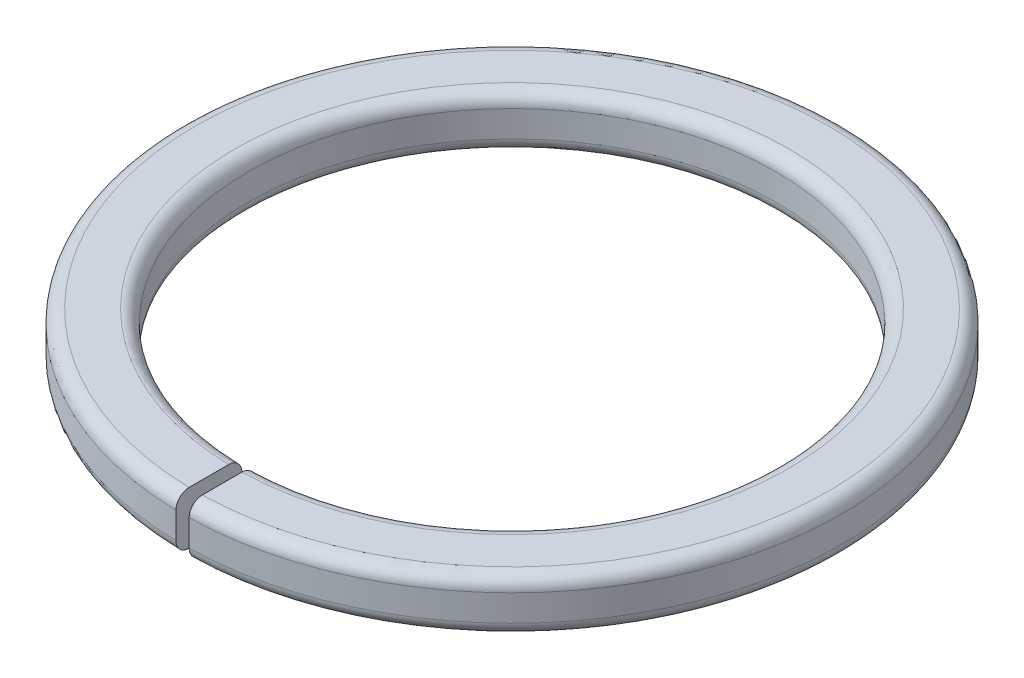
SolidWorks part; units mm, degrees
ref_plane "Front" through (0, 0, 0) normal (0, 0, 1) x (1, 0, 0)
ref_plane "Top" through (0, 0, 0) normal (0, 1, 0) x (1, 0, 0)
ref_plane "Right" through (0, 0, 0) normal (1, 0, 0) x (0, 0, -1)
sketch "Sketch1" plane through (0, 0, 0) normal (0, 1, 0) x (1, 0, 0)
  circle A0 centre (0, 0) radius 5
  circle A1 centre (0, 0) radius 4
extrude "Extrude1" add sketch "Sketch1" along normal blind 0.8
fillet "Fillet2" radius 0.2 4 edges at (0, 0, 5) (0, 0, 4) (0, 0.8, 4) (0, 0.8, 5)
sketch "Sketch2" plane through (0, 0.8, 0) normal (0, 1, 0) x (-1, 0, 0)
  line L0 (0.1, 0) -> (-0.1, 0)
  line L1 (0.1, 0) -> (0.1, 9.4824)
  line L2 (-0.1, 0) -> (-0.1, 9.4824)
  line L3 (0.1, 9.4824) -> (-0.1, 9.4824)
extrude "Cut-Extrude1" cut sketch "Sketch2" against normal blind 10
